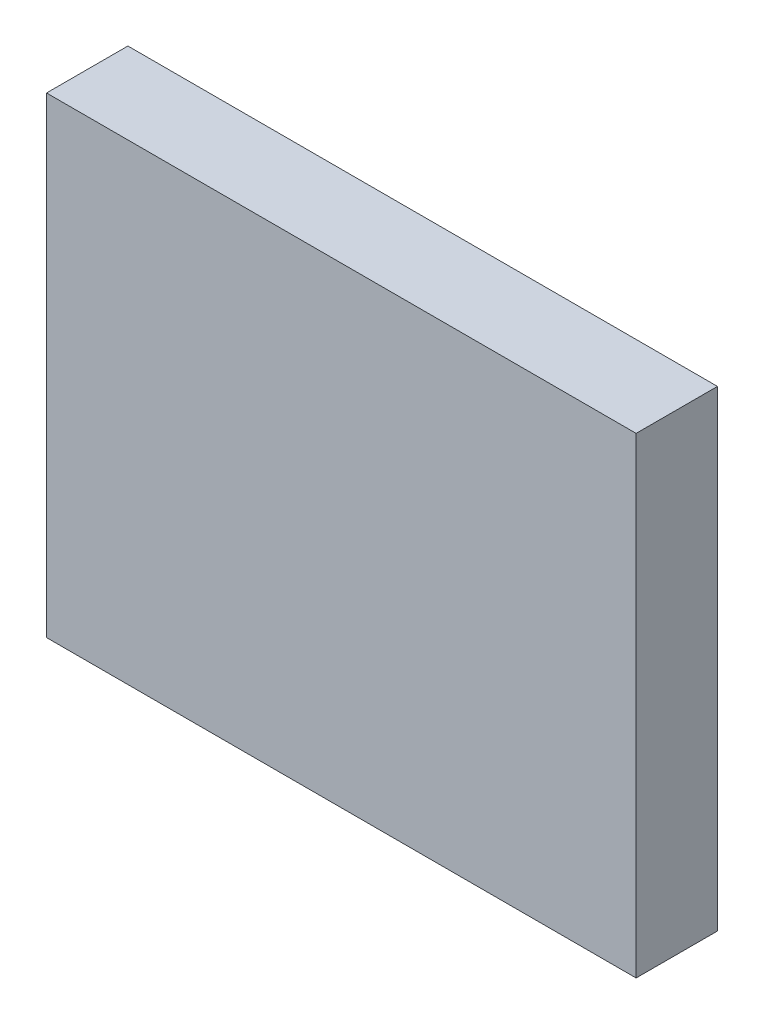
SolidWorks part; units mm, degrees
ref_plane "Plan de face" through (0, 0, 0) normal (0, 0, 1) x (1, 0, 0)
ref_plane "Plan de dessus" through (0, 0, 0) normal (0, 1, 0) x (1, 0, 0)
ref_plane "Plan de droite" through (0, 0, 0) normal (1, 0, 0) x (0, 0, -1)
sketch "Esquisse3" plane through (0, 0, 69.8734) normal (0, 0, 1) x (1, 0, 0)
  line L0 (200, -200) -> (-300, -200)
  line L1 (-300, -200) -> (-300, 200)
  line L2 (-300, 200) -> (200, 200)
  line L3 (200, 200) -> (200, -200)
extrude "Extrusion1" add sketch "Esquisse3" along normal blind 70
other "Empreinte1"
other "NEGATIF MILIEU<1>@E D M1"
other "MODELE<1>@E D M1"
